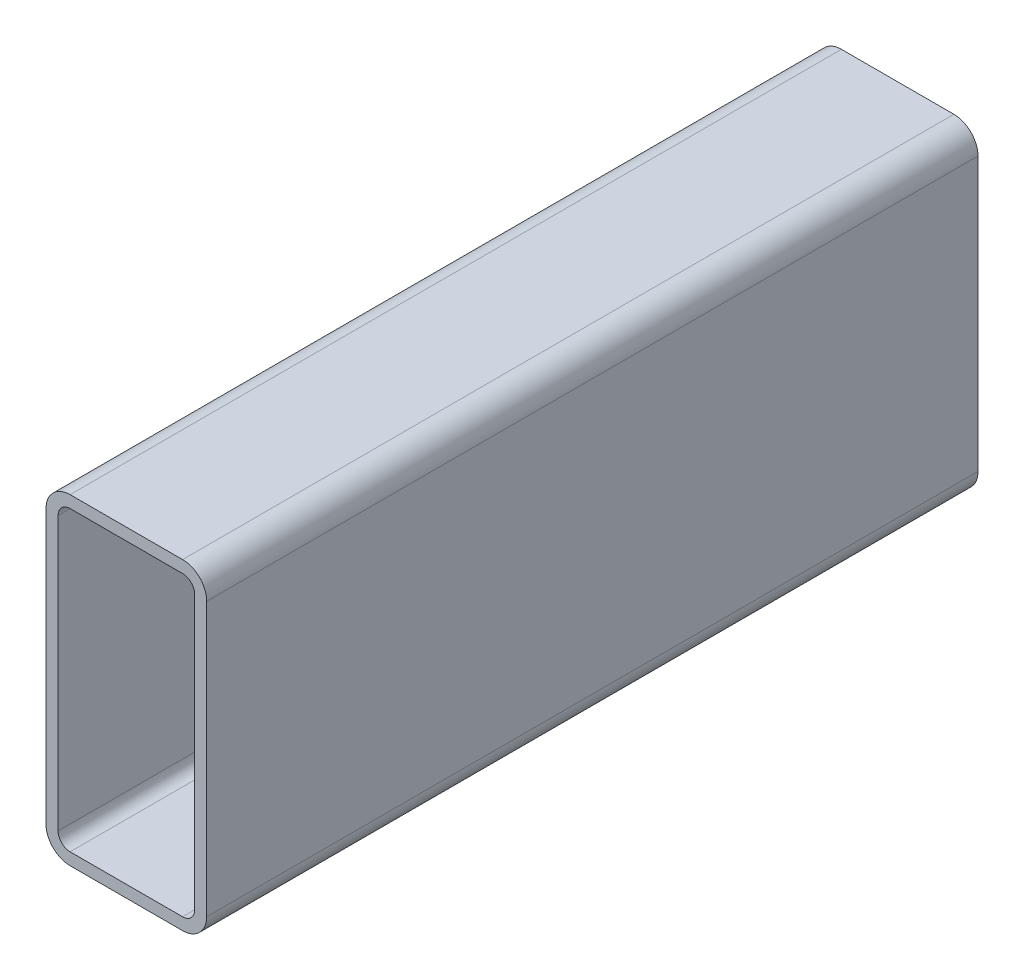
SolidWorks part; units mm, degrees
ref_plane "Front Plane" through (0, 0, 0) normal (0, 0, 1) x (1, 0, 0)
ref_plane "Top Plane" through (0, 0, 0) normal (0, 1, 0) x (1, 0, 0)
ref_plane "Right Plane" through (0, 0, 0) normal (1, 0, 0) x (0, 0, -1)
sketch "Sketch1" plane through (0, 0, 0) normal (0, 0, 1) x (1, 0, 0)
sketch_block_instance "HSS5x2.5x0.1875-1"
sketch_block "HSS5x2.5x0.1875"
extrude "Boss-Extrude1" add sketch "Sketch1" along normal blind 304.8
